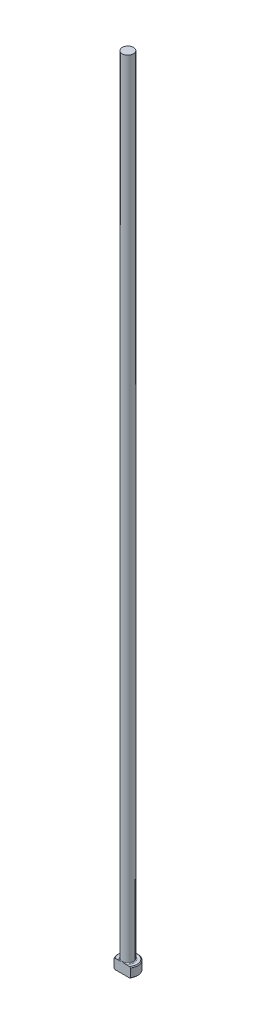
SolidWorks part; units mm, degrees
ref_plane "Front Plane" through (0, 0, 0) normal (0, 0, 1) x (1, 0, 0)
ref_plane "Top Plane" through (0, 0, 0) normal (0, 1, 0) x (1, 0, 0)
ref_plane "Right Plane" through (0, 0, 0) normal (1, 0, 0) x (0, 0, -1)
sketch "Sketch1" plane through (0, 0, 0) normal (0, 0, 1) x (1, 0, 0)
  line L0 (0, 259.9588) -> (0, -15.1925) construction
  line L1 (0, 0) -> (-3.175, 0)
  line L2 (-3.175, 0) -> (-3.175, 3.175)
  line L3 (-3.175, 3.175) -> (-1.7856, 3.175)
  line L4 (-1.7856, 3.175) -> (-1.7856, 254)
  line L5 (-1.7856, 254) -> (0, 254)
  line L6 (0, 254) -> (0, 0)
  dimension "L" = 254
  dimension "H" = 6.35
  dimension "T" = 3.175
  dimension "D" = 3.5712
revolve "Revolve1" add sketch "Sketch1" angle 360 about L0
chamfer "Chamfer1" distance 0.254 angle 45 2 edges at (0, 3.175, 3.175) (0, 0, 3.175)
fillet "Fillet1" radius 0.254 1 edges at (0, 3.175, 1.7856)
sketch "Sketch2" plane through (0, 0, 0) normal (0, -1, 0) x (1, 0, 0)
  line L0 (-2.6253, 1.7856) -> (2.6253, 1.7856)
  arc A0 (2.6253, 1.7856) -> (-2.6253, 1.7856) centre (0, 0) ccw
  circle A1 centre (0, 0) radius 3.175 construction
  circle A3 centre (0, 0) radius 1.7856 construction
extrude "KEY" cut sketch "Sketch2" against normal through all
sketch "Pocket Sketch" plane through (0, 0, 0) normal (0, 0, 1) x (1, 0, 0)
  line L0 (-3.5719, 0) -> (-3.5719, 3.2004)
  line L1 (-3.5719, 3.2004) -> (-2.7461, 3.2004)
  line L2 (-1.9841, 3.9624) -> (-1.9841, 22.225)
  line L3 (-1.9841, 22.225) -> (0, 22.225)
  line L4 (0, 22.225) -> (0, 0)
  line L5 (0, 0) -> (-3.5719, 0)
  line L6 (0, 12.6104) -> (0, -2.4989) construction
  line L7 (-3.175, 2.921) -> (-3.175, 0.254) construction
  line L8 (2.921, 3.175) -> (-2.921, 3.175) construction
  line L9 (-1.7856, 254) -> (-1.7856, 3.429) construction
  line L10 (-2.7461, 3.2004) -> (-1.9841, 3.9624)
  point P3 (-1.9841, 3.2004)
  dimension "D1" = 7.1437
  dimension "D2" = 0.3969
  dimension "D3" = 0.0254
  dimension "D4" = 0.1984
  dimension "D5" = 3.9681
  dimension "D6" = 22.225
